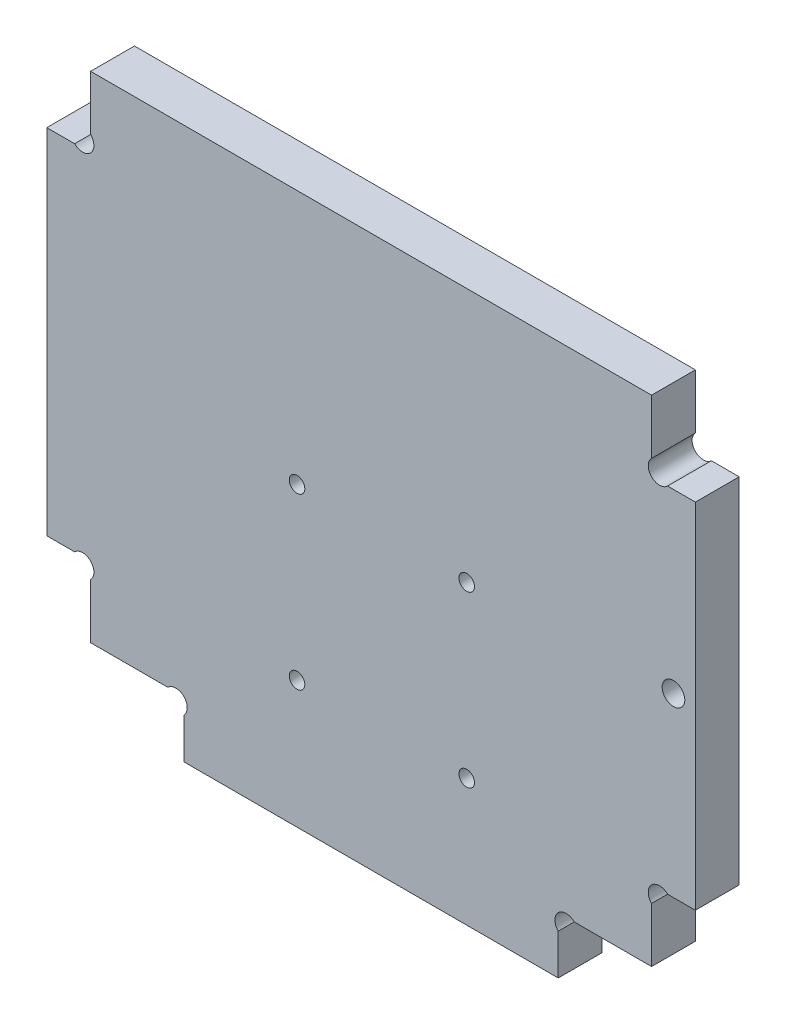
SolidWorks part; units mm, degrees
ref_plane "Face" through (0, 0, 0) normal (0, 0, 1) x (1, 0, 0)
ref_plane "Dessus" through (0, 0, 0) normal (0, 1, 0) x (1, 0, 0)
ref_plane "Droite" through (0, 0, 0) normal (1, 0, 0) x (0, 0, -1)
sketch "Esquisse1" plane through (0, 0, 0) normal (0, 0, 1) x (1, 0, 0)
  line L0 (45.875, -19.1604) -> (45.875, 34.646) construction
  line L1 (-28.0225, 80) -> (114.0402, 80) construction
  line L2 (6.2, 80) -> (85.55, 80)
  line L3 (91.75, 88.4524) -> (91.75, -19.1604) construction
  line L4 (-28.0225, 20) -> (12.2447, 20) construction
  line L5 (0, -19.1604) -> (0, 88.4524) construction
  line L6 (-28.0225, 0) -> (114.0402, 0) construction
  line L7 (-28.0225, 10) -> (114.0402, 10) construction
  line L8 (-28.0225, 45) -> (12.2447, 45) construction
  line L9 (6.2, 20) -> (-2.8689, 10.9311) construction
  line L10 (6.2, -19.1604) -> (6.2, 88.4524) construction
  line L11 (19.4, -19.1604) -> (19.4, 23.4146) construction
  line L12 (6.2, 17.7373) -> (6.2, 10)
  line L13 (3.9373, 20) -> (0, 20)
  line L14 (19.4, 10) -> (6.9625, -2.4375) construction
  line L15 (6.2, 10) -> (17.1373, 10)
  line L16 (6.2, 72.2627) -> (6.2, 80)
  line L17 (19.4, 7.7373) -> (19.4, 2)
  line L18 (72.35, 7.7373) -> (72.35, 2)
  line L19 (85.55, 10) -> (74.6127, 10)
  line L20 (3.9373, 70) -> (0, 70)
  line L21 (85.55, 17.7373) -> (85.55, 10)
  line L22 (87.8127, 20) -> (91.75, 20)
  line L23 (85.55, -19.1604) -> (85.55, 34.646) construction
  line L24 (87.8127, 70) -> (91.75, 70)
  line L25 (85.55, 72.2627) -> (85.55, 80)
  line L26 (3.1, 50.08) -> (3.1, 43.1131) construction
  line L27 (19.4, 2) -> (72.35, 2)
  line L28 (91.75, 20) -> (91.75, 70)
  line L30 (0, 20) -> (0, 70)
  arc A0 (6.2, 17.7373) -> (3.9373, 20) centre (5.0686, 18.8686) ccw
  arc A1 (19.4, 7.7373) -> (17.1373, 10) centre (18.2686, 8.8686) ccw
  arc A2 (72.35, 7.7373) -> (74.6127, 10) centre (73.4814, 8.8686) cw
  arc A3 (6.2, 72.2627) -> (3.9373, 70) centre (5.0686, 71.1314) cw
  arc A4 (85.55, 17.7373) -> (87.8127, 20) centre (86.6814, 18.8686) cw
  arc A5 (85.55, 72.2627) -> (87.8127, 70) centre (86.6814, 71.1314) ccw
  circle A7 centre (88.65, 45) radius 1.6
  dimension "D7" = 45
  dimension "D8" = 3.1
  dimension "D9" = 70
  dimension "D10" = 8
  dimension "D1" = 13.2
  dimension "D2" = 39.675
  dimension "D3" = 10
  dimension "D4" = 10
  dimension "D5" = 25
  dimension "D6" = 45
extrude "Extrusion1" add sketch "Esquisse1" along normal blind 6.2
sketch "Esquisse2" plane through (0, 0, 0) normal (0, 0, -1) x (-1, 0, 0)
  line L0 (-96.3939, 10) -> (9.9083, 10) construction
  line L1 (-47.4, -3.3308) -> (-47.4, 83.432) construction
  line L2 (-91.75, 3.4523) -> (-91.75, 83.432) construction
  line L3 (-73.9185, 20) -> (-52.4556, 20) construction
  line L4 (-59.4, 14.4875) -> (-59.4, 48.5042) construction
  line L5 (-73.9185, 44) -> (-52.4556, 44) construction
  circle A0 centre (-59.4, 20) radius 1.1
  circle A1 centre (-59.4, 44) radius 1.1
  circle A2 centre (-35.4, 44) radius 1.1
  circle A3 centre (-35.4, 20) radius 1.1
  dimension "D1" = 44.35
  dimension "D2" = 24
  dimension "D3" = 12
extrude "Enlèv. mat.-Extru.1" cut sketch "Esquisse2" against normal blind 7
